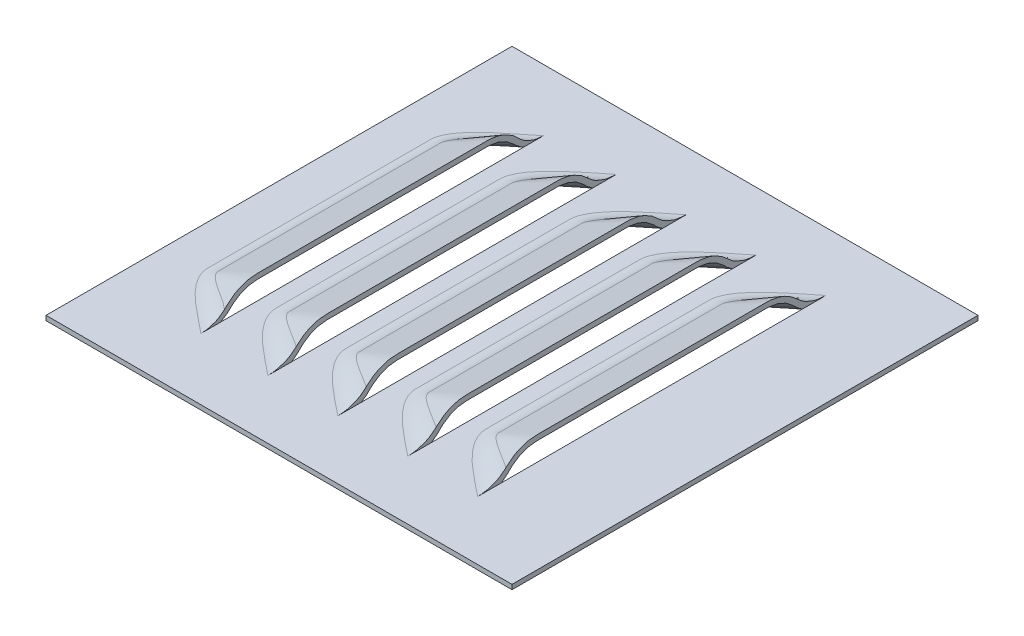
SolidWorks part; units mm, degrees
ref_plane "Ebene vorne" through (0, 0, 0) normal (0, 0, 1) x (1, 0, 0)
ref_plane "Ebene oben" through (0, 0, 0) normal (0, 1, 0) x (1, 0, 0)
ref_plane "Ebene rechts" through (0, 0, 0) normal (1, 0, 0) x (0, 0, -1)
sketch "Skizze1" plane through (0, 0, 0) normal (0, 1, 0) x (1, 0, 0)
  line L1 (0, 0) -> (100, 0)
  line L2 (0, 0) -> (0, 100)
  line L3 (0, 100) -> (100, 100)
  line L4 (100, 0) -> (100, 100)
  dimension "D1" = 100
  dimension "D2" = 100
extrude "Linear austragen1" add sketch "Skizze1" along normal blind 1
ref_plane "Ebene1" through (10, 0, 0) normal (1, 0, 0) x (0, 0, -1)
sketch "Skizze2" plane through (10, 0, 0) normal (1, 0, 0) x (0, 0, -1)
  line L0 (23, -2) -> (77, -2)
  line L1 (77, -2) -> (75.8787, -0.8787)
  line L2 (73.7574, 0) -> (26.2426, 0)
  line L3 (24.1213, -0.8787) -> (23, -2)
  line L4 (50, 20.9794) -> (50, -42.8454) construction
  line L7 (0, 1) -> (0, 0) construction
  line L8 (100, 1) -> (100, 0) construction
  line L9 (0, 0) -> (100, 0) construction
  arc A0 (26.2426, 0) -> (24.1213, -0.8787) centre (26.2426, -3) ccw
  arc A1 (75.8787, -0.8787) -> (73.7574, 0) centre (73.7574, -3) ccw
  point P16 (25, 0)
  point P19 (75, 0)
  dimension "D3" = 3
  dimension "D1" = 45
  dimension "D2" = 50
  dimension "D4" = 2
ref_plane "Ebene2" through (20, 0, 0) normal (1, 0, 0) x (0, 0, -1)
sketch "Skizze5" plane through (20, 0, 0) normal (1, 0, 0) x (0, 0, -1)
  line L0 (50, 20.9794) -> (50, -42.8454) construction
  line L1 (50, 20.9794) -> (50, -42.8454) construction
  line L2 (15, -2) -> (19.6569, 2.6569)
  line L3 (25.3137, 5) -> (74.6863, 5)
  line L4 (80.3431, 2.6569) -> (85, -2)
  line L5 (85, -2) -> (15, -2)
  line L7 (23, -2) -> (77, -2) construction
  arc A0 (19.6569, 2.6569) -> (25.3137, 5) centre (25.3137, -3) cw
  arc A1 (74.6863, 5) -> (80.3431, 2.6569) centre (74.6863, -3) cw
  dimension "D3" = 8
  dimension "D1" = 7
  dimension "D2" = 45
  dimension "D4" = 70
loft "Ausformung1" add profiles "Skizze2", "Skizze5"
pattern_linear "Lineares Muster1" count 5 spacing 15 along (1, 0, 0)
other "Einbuchtung1" parameters "D1"=1, "D2"=0
delete or keep bodies "Körper-Löschen1" type delete bodies bodies 106 112 113 114 115
sketch "Skizze8" plane through (21, 0, 0) normal (1, 0, 0) x (0, 0, -1)
  line L2 (15.5752, 1) -> (84.4248, 1)
  line L3 (74.6863, 6.618) -> (25.3137, 6.618)
  line L4 (15.5752, 1) -> (84.4248, 1)
  line L5 (74.6863, 6.618) -> (25.3137, 6.618)
  spline S4 degree 3 poles (2772.8516, -2895.0272) (31.9464, 34.7509) (29.2063, 14.6311) (17.9795, 3.4044) (17.6189, 3.0437) (-926.0239, -940.5991) (-1869.5465, -1884.1217) (-2812.8296, -2827.4055) knots -11.423306 -11.423306 -11.423306 -11.423306 0.125 0.125 0.25 0.5 981.304836 981.304836 981.304836 981.304836 only from (18.461, 3.8846) to (15.5752, 1)
  spline S5 degree 3 poles (2912.8449, -2827.419) (1969.5562, -1884.1313) (1026.0287, -940.6039) (82.3811, 3.0437) (82.0205, 3.4044) (70.7976, 14.6272) (68.0555, 34.7369) (-2669.9908, -2891.9692) knots -980.309862 -980.309862 -980.309862 -980.309862 0.5 0.75 0.875 0.875 12.419287 12.419287 12.419287 12.419287 only from (84.4248, 1) to (81.539, 3.8846)
  spline S6 degree 3 poles (-2625.1883, -2938.7956) (-83.7705, -297.7644) (118.2238, -25.4336) (80.581, 4.71) (80.3238, 4.8967) (79.5309, 5.4128) (78.9703, 5.7004) (77.7913, 6.1737) (77.1877, 6.3479) (76.2627, 6.5161) (75.9513, 6.5577) (75.4792, 6.5975) (75.3207, 6.6068) (59.9836, 7.1312) (44.7657, -38.7932) (33.0182, 4005.7463) knots -18.759527 -18.759527 -18.759527 -18.759527 0.125 0.125 0.25 0.25 0.5 0.5 0.75 0.75 0.875 0.875 0.9375 0.9375 6.918485 6.918485 6.918485 6.918485 only from (81.539, 3.8846) to (74.6863, 6.618)
  spline S7 degree 3 poles (-102.7171, 4004.127) (56.5566, -37.0938) (39.7434, 7.0947) (24.703, 6.6079) (24.5506, 6.5994) (24.0938, 6.5626) (23.7899, 6.5236) (22.8801, 6.3639) (22.2762, 6.1963) (21.0743, 5.7224) (20.5024, 5.4319) (19.6983, 4.9123) (19.4389, 4.725) (-3.2613, -13.3764) (34.5135, -140.624) (3720.6752, 1510.5599) knots -6.036159 -6.036159 -6.036159 -6.036159 0.0625 0.0625 0.125 0.125 0.25 0.25 0.5 0.5 0.75 0.75 0.875 0.875 12.036533 12.036533 12.036533 12.036533 only from (25.3137, 6.618) to (18.461, 3.8846)
  spline S8 degree 3 poles (18.461, 3.8846) (18.3392, 3.7661) (18.22, 3.6448) (17.9795, 3.4044) (17.6189, 3.0437) (16.7774, 2.2022) (16.0561, 1.4809) (15.5752, 1) knots 0 0 0 0 0.125 0.125 0.25 0.5 1 1 1 1
  spline S9 degree 3 poles (84.4248, 1) (83.9439, 1.4809) (83.2226, 2.2022) (82.3811, 3.0437) (82.0205, 3.4044) (81.78, 3.6448) (81.6608, 3.7661) (81.539, 3.8846) knots 0 0 0 0 0.5 0.75 0.875 0.875 1 1 1 1
  spline S10 degree 3 poles (81.539, 3.8846) (81.3131, 4.1047) (81.0761, 4.3135) (80.581, 4.71) (80.3238, 4.8967) (79.5309, 5.4128) (78.9703, 5.7004) (77.7913, 6.1737) (77.1877, 6.3479) (76.2627, 6.5161) (75.9513, 6.5577) (75.4792, 6.5975) (75.3207, 6.6068) (75.0035, 6.6177) (74.8449, 6.618) (74.6863, 6.618) knots 0 0 0 0 0.125 0.125 0.25 0.25 0.5 0.5 0.75 0.75 0.875 0.875 0.9375 0.9375 1 1 1 1
  spline S11 degree 3 poles (25.3137, 6.618) (25.1609, 6.618) (25.0081, 6.6178) (24.703, 6.6079) (24.5506, 6.5994) (24.0938, 6.5626) (23.7899, 6.5236) (22.8801, 6.3639) (22.2762, 6.1963) (21.0743, 5.7224) (20.5024, 5.4319) (19.6983, 4.9123) (19.4389, 4.725) (18.9361, 4.3241) (18.6922, 4.1099) (18.461, 3.8846) knots 0 0 0 0 0.0625 0.0625 0.125 0.125 0.25 0.25 0.5 0.5 0.75 0.75 0.875 0.875 1 1 1 1
  dimension "D1" = 0
extrude "Schnitt-Linear austragen3" cut sketch "Skizze8" against normal blind 1
pattern_linear "Lineares Muster5" count 5 spacing 15 along (1, 0, 0) of "Schnitt-Linear austragen3"
fillet "Verrundung3" radius 6 15 edges at (24.7639, 1, -38.7534) (35, 6.118, -60.0846) (39.7639, 1, -38.7534) (50, 6.118, -60.0846) (10.5047, 0, -75.055) (54.7639, 1, -38.7534) (65, 6.118, -60.0846) (15, 0, -21) (69.7639, 1, -38.7534) (80, 6.118, -60.0846)
fillet "Verrundung4" radius 5 30 edges at (40.5047, 0, -75.055) (45, 0, -21) (55.5047, 0, -75.055) (60, 0, -21) (73.068, 0, -77.4544) (72.5, 0, -23) (9.7639, 1, -38.7534) (20, 6.118, -60.0846) (25.5047, 0, -75.055) (30, 0, -21)
